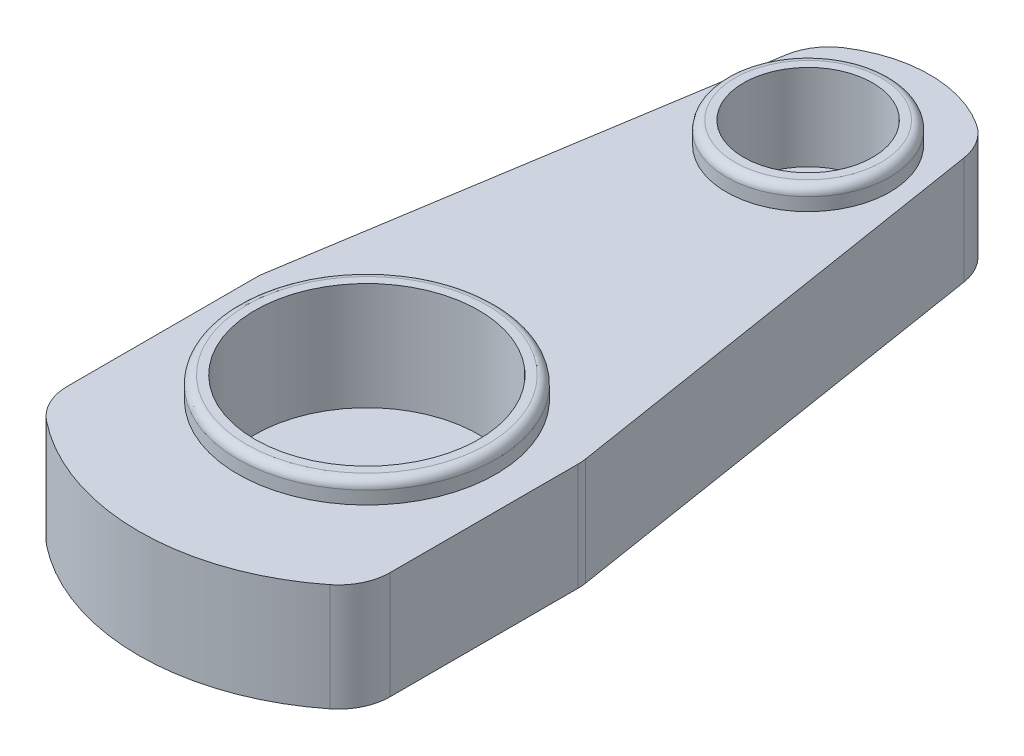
SolidWorks part; units mm, degrees
ref_plane "Alzado" through (0, 0, 0) normal (0, 0, 1) x (1, 0, 0)
ref_plane "Planta" through (0, 0, 0) normal (0, 1, 0) x (1, 0, 0)
ref_plane "Vista lateral" through (0, 0, 0) normal (1, 0, 0) x (0, 0, -1)
sketch "Croquis1" plane through (0, 0, 0) normal (0, 1, 0) x (1, 0, 0)
  line L0 (-37.5, -75) -> (-37.5, -25)
  line L5 (0, -90.5467) -> (0, 85) construction
  line L6 (-37.5, -25) -> (-20, 85)
  line L7 (37.5, -75) -> (37.5, -25)
  line L8 (37.5, -25) -> (20, 85)
  line L9 (-59.5766, 85) -> (59.5766, 85) construction
  arc A0 (37.5, -75) -> (-37.5, -75) centre (0, -37.5467) cw
  arc A1 (20, 85) -> (-20, 85) centre (0, 65) ccw
  point P0 (0, 0)
  point P11 (0, 85)
  dimension "D3" = 53
  dimension "D1" = 75
  dimension "D2" = 20
  dimension "D4" = 50
  dimension "D5" = 50
  dimension "D6" = 20
  dimension "D7" = 110
  dimension "D8" = 110
extrude "Saliente-Extruir1" add sketch "Croquis1" along normal blind 25
sketch "Croquis2" plane through (0, 25, 0) normal (0, 1, 0) x (1, 0, 0)
  circle A0 centre (0, -37.5467) radius 30
  dimension "D1" = 60
extrude "Saliente-Extruir2" add sketch "Croquis2" along normal blind 5
sketch "Croquis3" plane through (0, 30, 0) normal (0, 1, 0) x (1, 0, 0)
  circle A0 centre (0, -37.5467) radius 26
  dimension "D1" = 52
extrude "Cortar-Extruir1" cut sketch "Croquis3" against normal blind 25
fillet "Redondeo1" radius 2 1 edges at (0, 30, 67.5467)
sketch "Croquis4" plane through (0, 25, 0) normal (0, 1, 0) x (1, 0, 0)
  circle A0 centre (0, 65) radius 19
  dimension "D1" = 38
extrude "Saliente-Extruir3" add sketch "Croquis4" along normal blind 5
sketch "Croquis5" plane through (0, 30, 0) normal (0, 1, 0) x (1, 0, 0)
  circle A0 centre (0, 65) radius 15
  dimension "D1" = 30
extrude "Cortar-Extruir2" cut sketch "Croquis5" against normal blind 20
fillet "Redondeo2" radius 2 1 edges at (0, 30, -46)
fillet "Redondeo3" radius 12 6 edges at (-20, 12.5, -85) (20, 12.5, -85) (37.5, 12.5, 25) (-37.5, 12.5, 25) (-37.5, 12.5, 75) (37.5, 12.5, 75)
